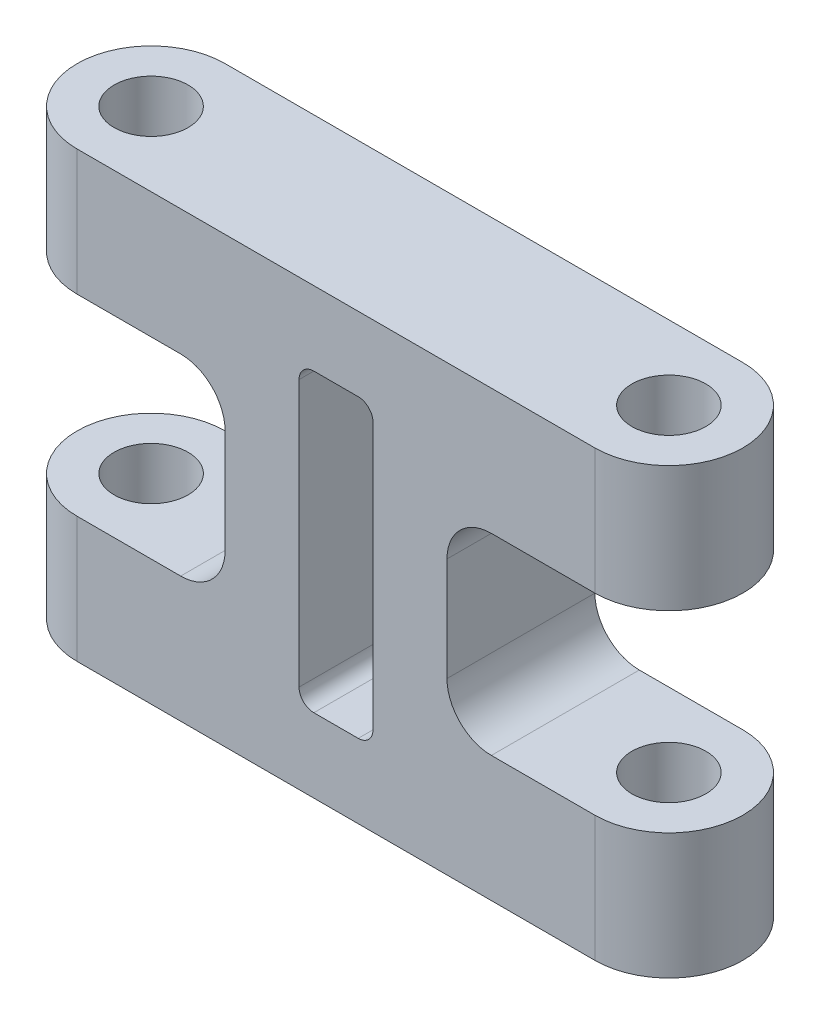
SolidWorks part; units mm, degrees
ref_plane "Alzado" through (0, 0, 0) normal (0, 0, 1) x (1, 0, 0)
ref_plane "Planta" through (0, 0, 0) normal (0, 1, 0) x (1, 0, 0)
ref_plane "Vista lateral" through (0, 0, 0) normal (1, 0, 0) x (0, 0, -1)
sketch "Croquis1" plane through (0, 0, 0) normal (0, 1, 0) x (1, 0, 0)
  line L0 (-17.5, 0) -> (17.5, 0) construction
  line L1 (-17.5, 5) -> (17.5, 5)
  line L2 (-17.5, -5) -> (17.5, -5)
  arc A0 (-17.5, 5) -> (-17.5, -5) centre (-17.5, 0) ccw
  arc A1 (17.5, -5) -> (17.5, 5) centre (17.5, 0) ccw
  point P2 (0, 0)
  dimension "D1" = 35
  dimension "D2" = 10
extrude "Saliente-Extruir1" add sketch "Croquis1" along normal mid plane 30
sketch "Croquis2" plane through (0, 0, -5) normal (0, 0, -1) x (1, 0, 0)
  line L0 (-22.5, 15) -> (-22.5, -15) construction
  line L1 (-22.5, 6.5) -> (-7.5, 6.5)
  line L2 (-22.5, 6.5) -> (-22.5, -6.5)
  line L3 (-22.5, -6.5) -> (-7.5, -6.5)
  line L4 (-7.5, 6.5) -> (-7.5, -6.5)
  line L5 (-7.5, 0) -> (0, 0) construction
  line L6 (-17.5, -15) -> (-17.5, 15) construction
  line L7 (22.5, -15) -> (22.5, 15) construction
  line L8 (22.5, 6.5) -> (7.5, 6.5)
  line L9 (22.5, 6.5) -> (22.5, -6.5)
  line L10 (22.5, -6.5) -> (7.5, -6.5)
  line L11 (7.5, 6.5) -> (7.5, -6.5)
  dimension "D1" = 10
  dimension "D2" = 13
extrude "Cortar-Extruir1" cut sketch "Croquis2" against normal through all
sketch "Croquis3" plane through (0, 15, 0) normal (0, 1, 0) x (1, 0, 0)
  circle A0 centre (-17.5, 0) radius 2.5
  circle A1 centre (17.5, 0) radius 2.5
  dimension "D1" = 5
extrude "Cortar-Extruir2" cut sketch "Croquis3" against normal through all
sketch "Croquis4" plane through (0, 0, 5) normal (0, 0, 1) x (1, 0, 0)
  line L0 (7.5, -6.5) -> (7.5, 6.5) construction
  line L1 (-2.5, -10) -> (2.5, -10)
  line L2 (-2.5, -10) -> (-2.5, 10)
  line L3 (-2.5, 10) -> (2.5, 10)
  line L4 (2.5, -10) -> (2.5, 10)
  line L5 (-2.5, -10) -> (2.5, 10) construction
  line L6 (-2.5, 10) -> (2.5, -10) construction
  line L7 (-17.5, 15) -> (17.5, 15) construction
  point P0 (0, 0)
  dimension "D1" = 5
  dimension "D2" = 5
extrude "Cortar-Extruir3" cut sketch "Croquis4" against normal through all
fillet "Redondeo1" radius 1 4 edges at (-2.5, -10, 0) (2.5, -10, 0) (2.5, 10, 0) (-2.5, 10, 0)
fillet "Redondeo2" radius 3 4 edges at (7.5, -6.5, 0) (-7.5, -6.5, 0) (-7.5, 6.5, 0) (7.5, 6.5, 0)
